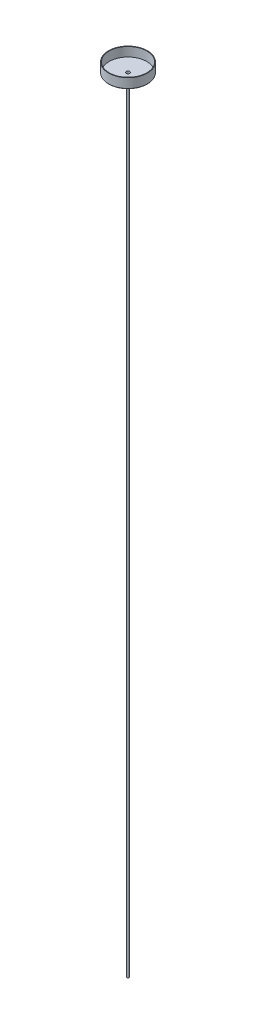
SolidWorks part; units mm, degrees
ref_plane "Alzado" through (0, 0, 0) normal (0, 0, 1) x (1, 0, 0)
ref_plane "Planta" through (0, 0, 0) normal (0, 1, 0) x (1, 0, 0)
ref_plane "Vista lateral" through (0, 0, 0) normal (1, 0, 0) x (0, 0, -1)
sketch "Croquis1" plane through (0, 0, 0) normal (0, 1, 0) x (1, 0, 0)
  circle A0 centre (0, 0) radius 3
  dimension "D1" = 6
extrude "Saliente-Extruir1" add sketch "Croquis1" along normal blind 2000
sketch "Croquis2" plane through (0, 2000, 0) normal (0, 1, 0) x (1, 0, 0)
  circle A0 centre (0, 0) radius 6
  dimension "D1" = 12
extrude "Saliente-Extruir2" add sketch "Croquis2" along normal blind 15 separate body
sketch "Croquis3" plane through (0, 2015, 0) normal (0, 1, 0) x (1, 0, 0)
  circle A0 centre (0, 0) radius 50
  dimension "D1" = 100
extrude "Saliente-Extruir3" add sketch "Croquis3" along normal blind 25
fillet "Redondeo1" radius 1 1 edges at (0, 2015, 50)
shell "Vaciado1" thickness 1.5
